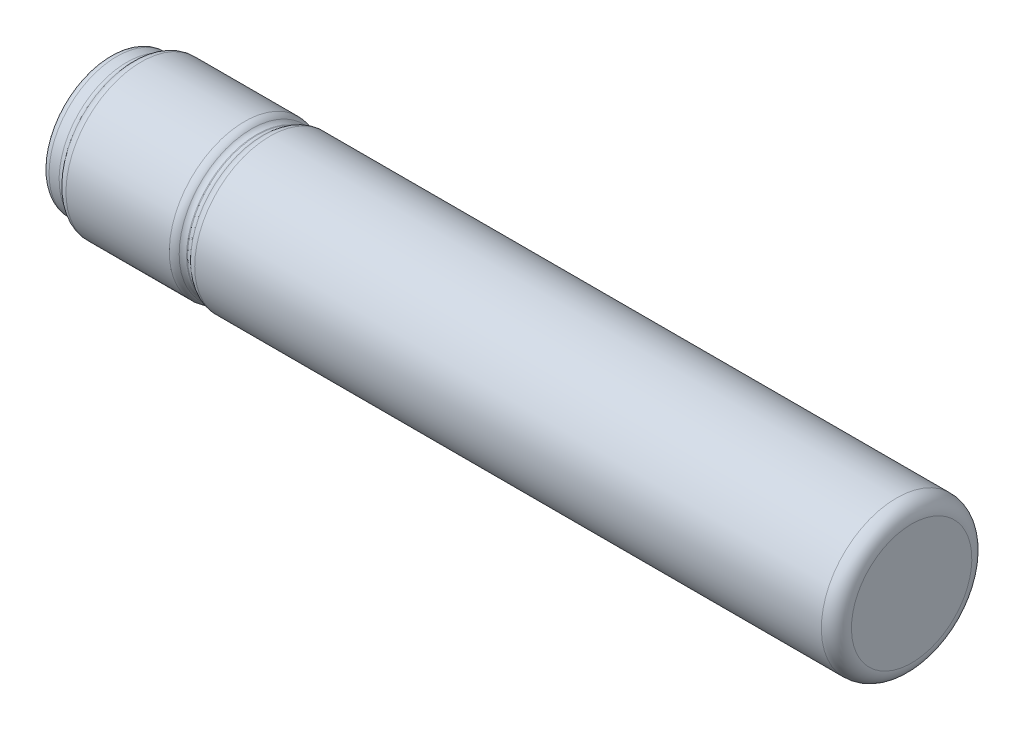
SolidWorks part; units mm, degrees
ref_plane "Plan de face" through (0, 0, 0) normal (0, 0, 1) x (1, 0, 0)
ref_plane "Plan de dessus" through (0, 0, 0) normal (0, 1, 0) x (1, 0, 0)
ref_plane "Plan de droite" through (0, 0, 0) normal (1, 0, 0) x (0, 0, -1)
sketch "Esquisse1" plane through (0, 0, 0) normal (0, 0, 1) x (1, 0, 0)
  line L0 (-0.9837, 2.9) -> (0, 2.9)
  line L2 (0, 2.9) -> (0, 3)
  line L3 (0, 3) -> (0, 4.75)
  line L4 (0, 4.75) -> (-0.5, 4.75)
  line L5 (-0.5, 4.75) -> (-0.5, 6.75)
  line L6 (2, 7.5) -> (13.5, 7.5)
  line L7 (79.4742, 0) -> (79.4742, 7.5)
  line L9 (13.5, 7.5) -> (13.5, 7)
  line L10 (13.5, 7) -> (15, 7)
  line L11 (15, 7) -> (15, 7.5)
  line L12 (15, 7.5) -> (79.4742, 7.5)
  line L13 (-0.5, 6.75) -> (2, 6.75)
  line L14 (2, 6.75) -> (2, 7.5)
  line L17 (79.4742, 0) -> (-1.4837, 0)
  line L19 (-1.4837, 2.4) -> (-1.4837, 0)
  line L21 (-0.9837, 2.9) -> (-1.4837, 2.4)
  dimension "D5" = 14
  dimension "D7" = 0.5
  dimension "D8" = 1.5
  dimension "D9" = 2.5
  dimension "D10" = 0.75
  dimension "D11" = 2
revolve "Révolution1" add sketch "Esquisse1" angle 360 mid plane about L17
fillet "Congé1" radius 1.5 1 edges at (79.4742, 7.5, 0)
fillet "Congé2" radius 0.75 4 edges at (15, 7, 0) (13.5, 7, 0) (-0.5, 6.75, 0) (2, 6.75, 0)
fillet "Congé3" radius 1 3 edges at (13.5, 7.5, 0) (15, 7.5, 0) (2, 7.5, 0)
sketch "Esquisse3" plane through (0, 0, 0) normal (-1, 0, 0) x (0, 0, 1)
  circle A0 centre (0, 0) radius 2.9
extrude "Enlèv. mat.-Extru.1" cut sketch "Esquisse3" against normal blind 75 and the other way through all
